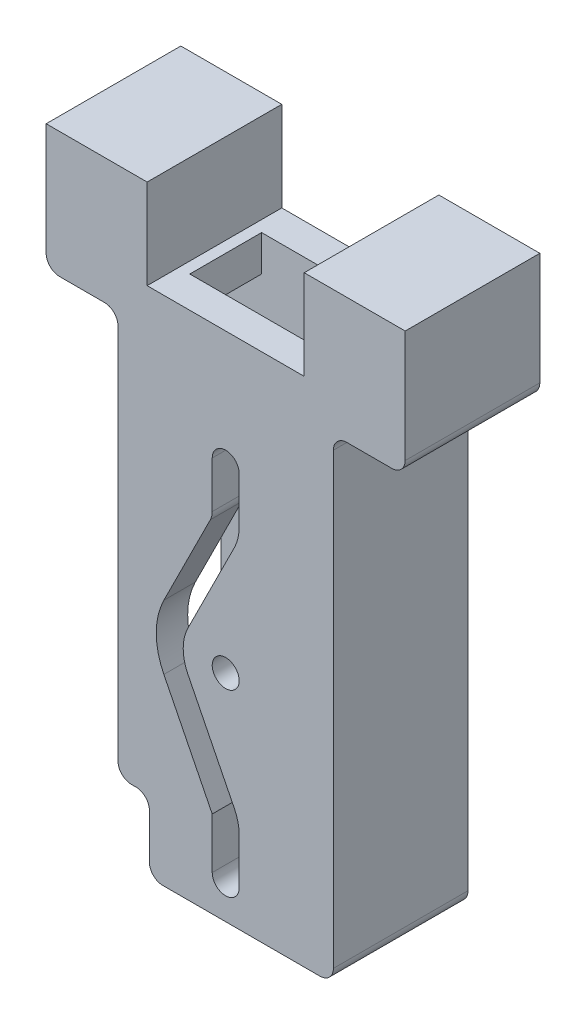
SolidWorks part; units mm, degrees
ref_plane "Face" through (0, 0, 0) normal (0, 0, 1) x (1, 0, 0)
ref_plane "Dessus" through (0, 0, 0) normal (0, 1, 0) x (1, 0, 0)
ref_plane "Droite" through (0, 0, 0) normal (1, 0, 0) x (0, 0, -1)
sketch "Esquisse1" plane through (0, 0, 0) normal (0, 0, 1) x (1, 0, 0)
  line L0 (0, 0) -> (0, 88.2106) construction
  line L1 (0, 0) -> (24, 0)
  line L2 (24, 0) -> (24, 106)
  line L3 (24, 106) -> (40, 106)
  line L4 (40, 106) -> (40, 134)
  line L5 (40, 134) -> (-40, 134)
  line L6 (-40, 134) -> (-40, 106)
  line L7 (-40, 106) -> (-24, 106)
  line L8 (-24, 106) -> (-24, 16)
  line L9 (-24, 16) -> (-17, 16)
  line L10 (-17, 16) -> (-17, 0)
  line L11 (-17, 0) -> (0, 0)
  dimension "D1" = 80
  dimension "D2" = 48
  dimension "D3" = 28
  dimension "D4" = 106
  dimension "D5" = 7
  dimension "D6" = 16
extrude "Base-Extrusion" add sketch "Esquisse1" along normal blind 30
fillet "Congé1" radius 3
sketch "Esquisse2" plane through (0, 134, 0) normal (0, 1, 0) x (-1, 0, 0)
  line L0 (0, 0) -> (0, 47.6984) construction
  line L1 (-40, 0) -> (40, 0) construction
  line L2 (-17.5, 0) -> (17.5, 0)
  line L3 (-17.5, 0) -> (-17.5, 30)
  line L4 (-17.5, 30) -> (17.5, 30)
  line L5 (17.5, 0) -> (17.5, 30)
  line L6 (-40, 30) -> (40, 30) construction
  dimension "D1" = 35
extrude "Enlèv. mat.-Extru.1" cut sketch "Esquisse2" against normal blind 20
sketch "Esquisse3" plane through (-24, 0, 0) normal (-1, 0, 0) x (0, 0, 1)
  line L0 (15, 134) -> (15, -7.3719) construction
  line L1 (30, 134) -> (0, 134) construction
  line L2 (30, 106) -> (0, 106) construction
  line L3 (23, 106) -> (7, 106)
  line L4 (23, 106) -> (23, 8)
  line L5 (23, 8) -> (7, 8)
  line L6 (7, 106) -> (7, 8)
  line L7 (30, 0) -> (0, 0) construction
  dimension "D1" = 16
  dimension "D2" = 8
extrude "Enlèv. mat.-Extru.2" cut sketch "Esquisse3" against normal blind 39
sketch "Esquisse5" plane through (0, 134, 0) normal (0, 1, 0) x (-1, 0, 0)
  line L0 (-15, 23) -> (24, 23) construction
  line L1 (-15, 7) -> (15, 7)
  line L2 (-15, 7) -> (-15, 23)
  line L3 (-15, 23) -> (15, 23)
  line L4 (15, 7) -> (15, 23)
  line L5 (0, 0) -> (0, 40.7143) construction
extrude "Enlèv. mat.-Extru.3" cut sketch "Esquisse5" against normal through all
sketch "Esquisse6" plane through (0, 0, 30) normal (0, 0, 1) x (1, 0, 0)
  line L0 (0, 114) -> (0, -14.2508) construction
  line L1 (-17.5, 114) -> (17.5, 114) construction
  line L2 (40, 134) -> (17.5, 134) construction
  line L3 (-10.1032, 20) -> (12.4429, 20) construction
  line L4 (-3, 88) -> (-3, 77.6525)
  line L5 (-12.6556, 76) -> (12.4429, 76) construction
  line L6 (3, 88) -> (3, 77.6525)
  line L7 (0, 20) -> (-14, 48) construction
  line L8 (0, 76) -> (-14, 48) construction
  line L9 (-3.4223, 75.8636) -> (-13.7764, 55.1554)
  line L10 (1.9443, 73.1803) -> (-8.4098, 52.4721)
  line L11 (-8.4098, 43.5279) -> (1.9443, 22.8197)
  line L12 (-13.7764, 40.8446) -> (-3, 19.2918)
  line L13 (3, 18.3475) -> (3, 8)
  line L14 (-3, 19.2918) -> (-3, 8)
  arc A0 (-3, 88) -> (3, 88) centre (0, 88) cw
  arc A1 (-3, 8) -> (3, 8) centre (0, 8) ccw
  arc A2 (-8.4098, 52.4721) -> (-8.4098, 43.5279) centre (0.5344, 48) ccw
  arc A3 (-13.7764, 55.1554) -> (-13.7764, 40.8446) centre (0.5344, 48) ccw
  arc A4 (-3, 77.6525) -> (-3.4223, 75.8636) centre (-7, 77.6525) cw
  arc A5 (3, 77.6525) -> (1.9443, 73.1803) centre (-7, 77.6525) cw
  arc A6 (3, 18.3475) -> (1.9443, 22.8197) centre (-7, 18.3475) ccw
  dimension "D1" = 3
  dimension "D2" = 46
  dimension "D3" = 80
  dimension "D5" = 12
  dimension "D12" = 10
  dimension "D13" = 16
  dimension "D14" = 4
  dimension "D15" = 10
  dimension "D4" = 12
  dimension "D6" = 28
  dimension "D7" = 14
  dimension "D8" = 3
  dimension "D9" = 3
  dimension "D10" = 3
  dimension "D11" = 3
extrude "Enlèv. mat.-Extru.4" cut sketch "Esquisse6" against normal through all
sketch "Esquisse7" plane through (0, 134, 0) normal (0, 1, 0) x (-1, 0, 0)
  line L0 (-40, 0) -> (40, 30) construction
  point P4 (0, 15)
ref_plane "Plan1" through (0, 0, 15) normal (0, 0, 1) x (1, 0, 0)
sketch "Esquisse8" plane through (0, 0, 15) normal (0, 0, 1) x (1, 0, 0)
  line L0 (0, 134) -> (0, 9.6033) construction
sketch "Esquisse9" plane through (0, 0, 30) normal (0, 0, 1) x (1, 0, 0)
  line L0 (0, 48) -> (63.2272, 48) construction
  line L1 (0, 134) -> (0, 9.6033) construction
  line L2 (0.5344, 48) -> (79.3325, 48) construction
  circle A1 centre (0, 48) radius 3
  arc A2 (-8.4098, 52.4721) -> (-8.4098, 43.5279) centre (0.5344, 48) ccw construction
  dimension "D1" = 6
extrude "Enlèv. mat.-Extru.5" cut sketch "Esquisse9" against normal through all
